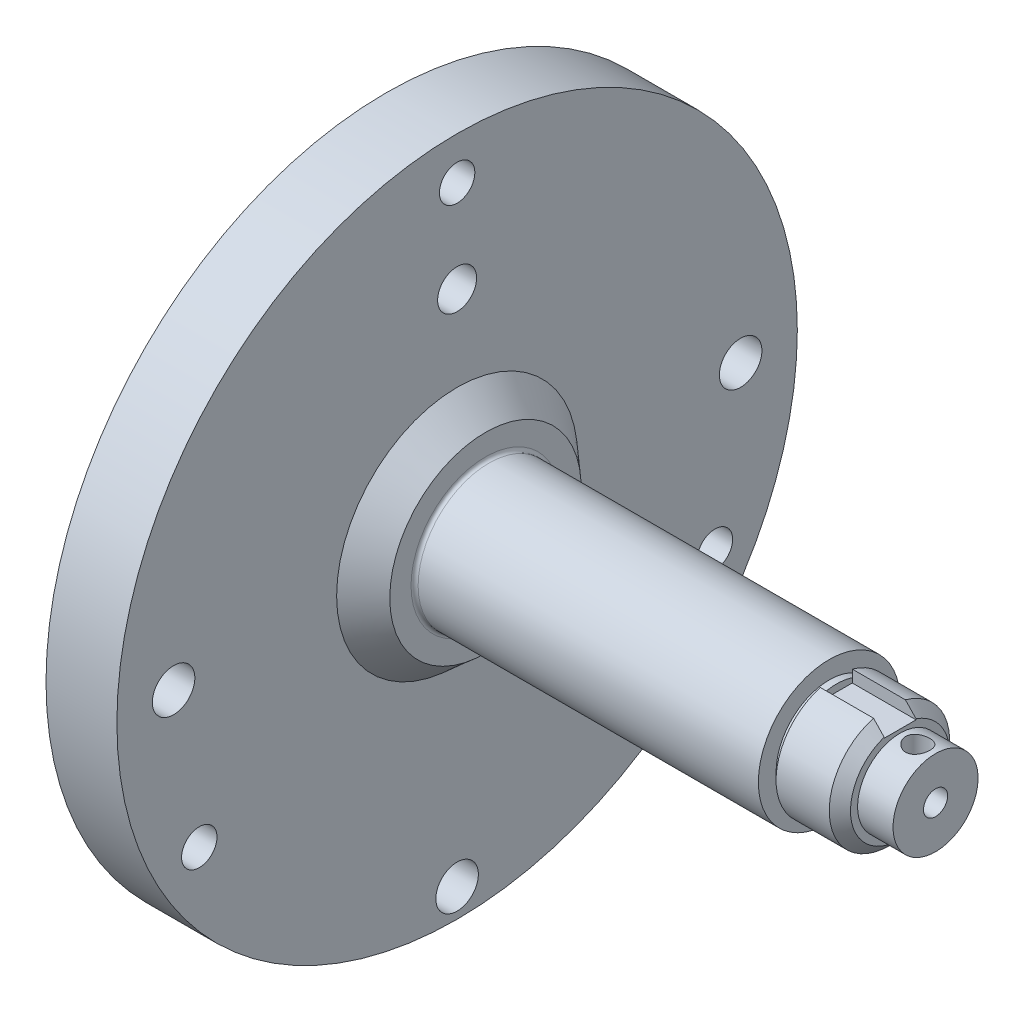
SolidWorks part; units mm, degrees
ref_plane "Plan de face" through (0, 0, 0) normal (0, 0, 1) x (1, 0, 0)
ref_plane "Plan de dessus" through (0, 0, 0) normal (0, 1, 0) x (1, 0, 0)
ref_plane "Plan de droite" through (0, 0, 0) normal (1, 0, 0) x (0, 0, -1)
sketch "Esquisse1" plane through (0, 0, 0) normal (0, 0, 1) x (1, 0, 0)
  line L0 (0, 0) -> (76, 0)
  line L1 (76, 0) -> (76, -6)
  line L2 (76, -6) -> (71, -6)
  line L3 (71, -6) -> (71, -7)
  line L4 (69.5, -8.5) -> (62, -8.5)
  line L5 (62, -8.5) -> (62, -7.5)
  line L6 (62, -7.5) -> (61, -7.5)
  line L7 (61, -7.5) -> (61, -10)
  line L8 (61, -10) -> (13, -10)
  line L9 (8.5, -17) -> (12.5, -13.5)
  line L10 (8.5, -17) -> (8.5, -48)
  line L11 (8.5, -48) -> (-1.5, -48)
  line L12 (-1.5, -48) -> (-1.5, -35)
  line L13 (-1.5, -35) -> (0, -35)
  line L14 (0, 0) -> (0, -35)
  line L15 (12.5, -13.5) -> (12.5, -10.5)
  line L16 (0, 0) -> (-50.8435, 0) construction
  line L17 (-50.8435, 0) -> (167.5419, 0) construction
  line L18 (71, -7) -> (69.5, -8.5)
  arc A0 (13, -10) -> (12.5, -10.5) centre (13, -10.5) ccw
  point P6 (71, -8.5)
  point P19 (12.5, -10)
  dimension "D12" = 0.5
  dimension "D1" = 1.5
  dimension "D2" = 5
  dimension "D3" = 10
  dimension "D4" = 17
  dimension "D5" = 48
  dimension "D6" = 35
  dimension "D7" = 10
  dimension "D8" = 6
  dimension "D9" = 13.5
  dimension "D10" = 4
  dimension "D11" = 76
  dimension "D13" = 10
  dimension "D14" = 1
  dimension "D15" = 1
  dimension "D16" = 17
  dimension "D17" = 1.5
  dimension "D18" = 45
revolve "Révolution2" add sketch "Esquisse1" angle 360 about L17
hole_wizard "Dégagement M32" positions "Esquisse3D2" profile "Esquisse5" hole size "M3" standard "Ansi Métrique"
sketch3d "Esquisse3D2"
  line L0 (76, 0, 0) -> (71, 0, 0) construction
  point P0 (0, 0, 0)
  point P3 (76, 0, 0)
sketch "Esquisse5" plane through (76, 0, 0) normal (0, 1, 0) x (0, 0, -1)
  line L0 (0, 0) -> (0, 14.9815)
  line L1 (0, 14.9815) -> (1.7, 14)
  line L2 (1.7, 14) -> (1.7, 0)
  line L5 (1.7, 0) -> (0, 0)
  line L10 (0, 14.9815) -> (-1.7, 14) construction
  line L11 (0, -6.35) -> (0, 107.95) construction
  dimension "Diamètre du perçage" = 3.4
  dimension "Profondeur du perçage" = 14
  dimension "Angle de pointe" = 120
sketch "Esquisse6" plane through (-1.5, 0, 0) normal (-1, 0, 0) x (0, 0, 1)
  line L0 (-57.7481, 0) -> (52.4783, 0) construction
  circle A1 centre (-40, 0) radius 3
  circle A2 centre (40, 0) radius 3
  dimension "D1" = 6
  dimension "D2" = 6
extrude "Enlèv. mat.-Extru.1" cut sketch "Esquisse6" against normal through all
sketch "Esquisse7" plane through (-1.5, 0, 0) normal (-1, 0, 0) x (0, 0, 1)
  line L0 (0, 0) -> (0, -56.7234) construction
  circle A2 centre (0, -44) radius 3
  dimension "D1" = 6
extrude "Enlèv. mat.-Extru.2" cut sketch "Esquisse7" against normal through all
sketch "Esquisse8" plane through (-1.5, 0, 0) normal (-1, 0, 0) x (0, 0, 1)
  line L0 (0, 54.5277) -> (0, -57.1626) construction
  circle A0 centre (0, 0) radius 42
sketch "Esquisse13" plane through (-1.5, 0, 0) normal (-1, 0, 0) x (0, 0, 1)
  line L0 (0, 0) -> (49.379, -28.509) construction
  line L1 (0, 0) -> (-48.1115, -27.7772) construction
  line L2 (0, 54.5277) -> (0, -57.1626) construction
  dimension "D1" = 60
  dimension "D2" = 60
hole_wizard "Trou taraudé M63" positions "Esquisse3D5" profile "Esquisse14" tap size "M6" standard "ISO"
sketch3d "Esquisse3D5"
  line L0 (-1.5, 54.5277, 0) -> (-1.5, -57.1626, 0) construction
  line L1 (-1.5, 0, 0) -> (-1.5, -27.7772, -48.1115) construction
  line L2 (-1.5, 0, 0) -> (-1.5, -28.509, 49.379) construction
  circle A0 centre (-1.5, 0, 0) radius 42 construction
  point P0 (-1.5, 42, 0)
  point P4 (-43.5, 0, 0)
  point P7 (-1.5, -21, -36.3731)
  point P11 (-1.5, -21, 36.3731)
sketch "Esquisse14" plane through (-1.5, 42, 0) normal (0, 1, 0) x (0, 0, 1)
  line L0 (0, 0) -> (0, 16.5022)
  line L1 (0, 16.5022) -> (2.5, 15)
  line L2 (2.5, 15) -> (2.5, 0)
  line L5 (2.5, 0) -> (0, 0)
  line L10 (0, 16.5022) -> (-2.5, 15) construction
  line L11 (0, -6.35) -> (0, 107.95) construction
  dimension "Diamètre du trou pour taraudage" = 5
  dimension "Profondeur du trou pour taraudage" = 15
  dimension "Angle de pointe" = 118
ref_plane "Plan2" through (73.5, -6, 0) normal (0, -1, 0) x (0, 0, 1)
ref_plane "Plan3" through (76, 0, 0) normal (1, 0, 0) x (0, 0, -1)
ref_plane "Plan8" through (0, 8.5, 0) normal (0, 1, 0) x (-1, 0, 0)
hole_wizard "Dégagement M37" positions "Esquisse3D16" profile "Esquisse43" hole size "M3" standard "Ansi Métrique"
sketch3d "Esquisse3D16"
  point P0 (73.5, 6, 0)
  dimension "D1" = 2.5
sketch "Esquisse43" plane through (73.5, 6, 0) normal (1, 0, 0) x (0, 0, 1)
  line L0 (0, 0) -> (0, 4.3)
  line L1 (0, 4.3) -> (1.7, 4.3)
  line L2 (1.7, 4.3) -> (1.7, 0)
  line L5 (1.7, 0) -> (0, 0)
  line L11 (0, -6.35) -> (0, 107.95) construction
  dimension "Diamètre du perçage jusqu'au prochain" = 3.4
  dimension "Profondeur du perçage jusqu'au prochain" = 4.3
sketch "Esquisse45" plane through (0, 8.5, 0) normal (0, 1, 0) x (-1, 0, 0)
  line L0 (-62, -7.5) -> (-62, 7.5) construction
  line L1 (-62, 2.25) -> (-71, 2.25)
  line L2 (-62, 2.25) -> (-62, -2.25)
  line L3 (-62, -2.25) -> (-71, -2.25)
  line L4 (-71, 2.25) -> (-71, -2.25)
  line L5 (-71, 6) -> (-71, -6) construction
  line L6 (-88.6396, 0) -> (12.039, 0) construction
  dimension "D1" = 4.5
  dimension "D2" = 2.25
extrude "Enlèv. mat.-Extru.3" cut sketch "Esquisse45" against normal blind 2
ref_plane "Plan9" through (8.5, 0, 0) normal (1, 0, 0) x (0, 0, -1)
sketch "Esquisse46" plane through (8.5, 0, 0) normal (1, 0, 0) x (0, 0, -1)
  line L0 (0, 50.9653) -> (0, 0) construction
  circle A0 centre (0, 0) radius 29
  dimension "D1" = 58
hole_wizard "Dégagement M51" positions "Esquisse3D17" profile "Esquisse47" hole size "M5" standard "Ansi Métrique"
sketch3d "Esquisse3D17"
  line L0 (8.5, 50.9653, 0) -> (8.5, 0, 0) construction
  circle A0 centre (8.5, 0, 0) radius 29 construction
  point P0 (8.5, 29, 0)
  point P4 (37.5, 0, 0)
sketch "Esquisse47" plane through (8.5, 29, 0) normal (0, 1, 0) x (0, 0, -1)
  line L0 (0, 0) -> (0, 13.6524)
  line L1 (0, 13.6524) -> (2.75, 12)
  line L2 (2.75, 12) -> (2.75, 0)
  line L5 (2.75, 0) -> (0, 0)
  line L10 (0, 13.6524) -> (-2.75, 12) construction
  line L11 (0, -6.35) -> (0, 107.95) construction
  dimension "Diamètre du perçage" = 5.5
  dimension "Profondeur du perçage" = 12
  dimension "Angle de pointe" = 118
